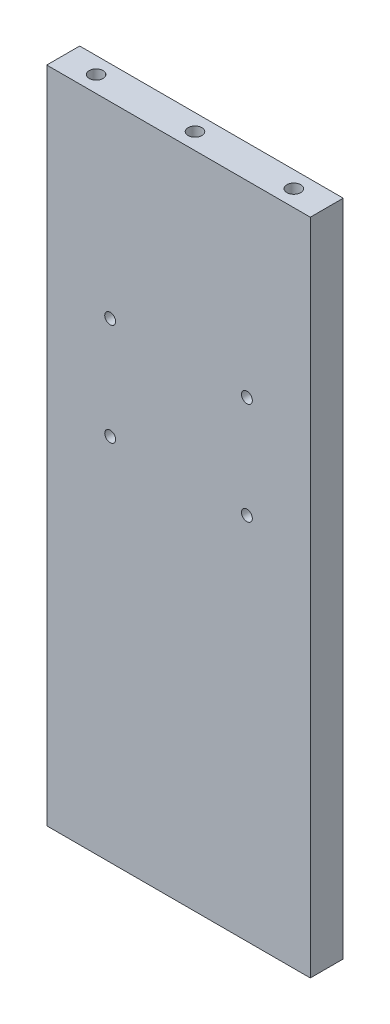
SolidWorks part; units mm, degrees
ref_plane "Спереди" through (0, 0, 0) normal (0, 0, 1) x (1, 0, 0)
ref_plane "Сверху" through (0, 0, 0) normal (0, 1, 0) x (1, 0, 0)
ref_plane "Справа" through (0, 0, 0) normal (1, 0, 0) x (0, 0, -1)
sketch "Эскиз1" plane through (0, 0, 0) normal (0, 0, 1) x (1, 0, 0)
  line L1 (40, 100) -> (-40, 100)
  line L2 (40, 100) -> (40, -100)
  line L3 (40, -100) -> (-40, -100)
  line L4 (-40, 100) -> (-40, -100)
  line L5 (40, 100) -> (-40, -100) construction
  line L6 (40, -100) -> (-40, 100) construction
  point P0 (0, 0)
  dimension "D1" = 200
  dimension "D2" = 80
extrude "Бобышка-Вытянуть1" add sketch "Эскиз1" along normal blind 10
hole_wizard "Отверстие обработанное метчиком M41" positions "Эскиз2" profile "Эскиз3" tap size "M4" standard "ISO"
sketch "Эскиз2" plane through (0, 0, 10) normal (0, 0, 1) x (1, 0, 0)
  line L0 (-40, -100) -> (40, -100) construction
  point P0 (-20.75, 43)
  point P2 (20.75, 43)
  point P4 (20.75, 12)
  point P6 (-20.75, 12)
  dimension "D1" = 41.5
  dimension "D2" = 31
  dimension "D3" = 112
  dimension "D4" = 20.75
sketch "Эскиз3" plane through (-20.75, 43, 10) normal (1, 0, 0) x (0, -1, 0)
  line L0 (0, 0) -> (0, 10)
  line L1 (0, 10) -> (1.65, 10)
  line L2 (1.65, 10) -> (1.65, 0)
  line L5 (1.65, 0) -> (0, 0)
  line L11 (0, -6.35) -> (0, 107.95) construction
  dimension "Диаметр проходного сверла" = 3.3
  dimension "Глубина проходного сверла" = 10
hole_wizard "Отверстие обработанное метчиком M52" positions "Эскиз4" profile "Эскиз5" tap size "M5" standard "ISO"
sketch "Эскиз4" plane through (0, 100, 0) normal (0, 1, 0) x (1, 0, 0)
  line L0 (40, 0) -> (-40, 0) construction
  line L1 (-40, -10) -> (-40, 0) construction
  line L2 (40, -10) -> (40, 0) construction
  point P0 (-30, -5)
  point P2 (0, -5)
  point P4 (30, -5)
  dimension "D1" = 5
  dimension "D2" = 10
  dimension "D3" = 10
  dimension "D4" = 40
sketch "Эскиз5" plane through (-30, 100, 5) normal (1, 0, 0) x (0, 0, 1)
  line L0 (0, 0) -> (0, 13.2618)
  line L1 (0, 13.2618) -> (2.1, 12)
  line L2 (2.1, 12) -> (2.1, 0)
  line L5 (2.1, 0) -> (0, 0)
  line L10 (0, 13.2618) -> (-2.1, 12) construction
  line L11 (0, -6.35) -> (0, 107.95) construction
  dimension "Диаметр сверла" = 4.2
  dimension "Глубина сверла" = 12
  dimension "Угол заточки сверла" = 118
hole_wizard "Отверстие обработанное метчиком M53" positions "Эскиз6" profile "Эскиз7" tap size "M5" standard "ISO"
sketch "Эскиз6" plane through (0, -100, 0) normal (0, -1, 0) x (-1, 0, 0)
  line L0 (40, -10) -> (40, 0) construction
  line L1 (-40, -10) -> (-40, 0) construction
  line L2 (40, -10) -> (-40, -10) construction
  point P0 (30, -5)
  point P2 (0, -5)
  point P4 (-30, -5)
  dimension "D1" = 10
  dimension "D2" = 40
  dimension "D3" = 10
  dimension "D4" = 5
sketch "Эскиз7" plane through (-30, -100, 5) normal (1, 0, 0) x (0, 0, -1)
  line L0 (0, 0) -> (0, 13.2618)
  line L1 (0, 13.2618) -> (2.1, 12)
  line L2 (2.1, 12) -> (2.1, 0)
  line L5 (2.1, 0) -> (0, 0)
  line L10 (0, 13.2618) -> (-2.1, 12) construction
  line L11 (0, -6.35) -> (0, 107.95) construction
  dimension "Диаметр сверла" = 4.2
  dimension "Глубина сверла" = 12
  dimension "Угол заточки сверла" = 118
